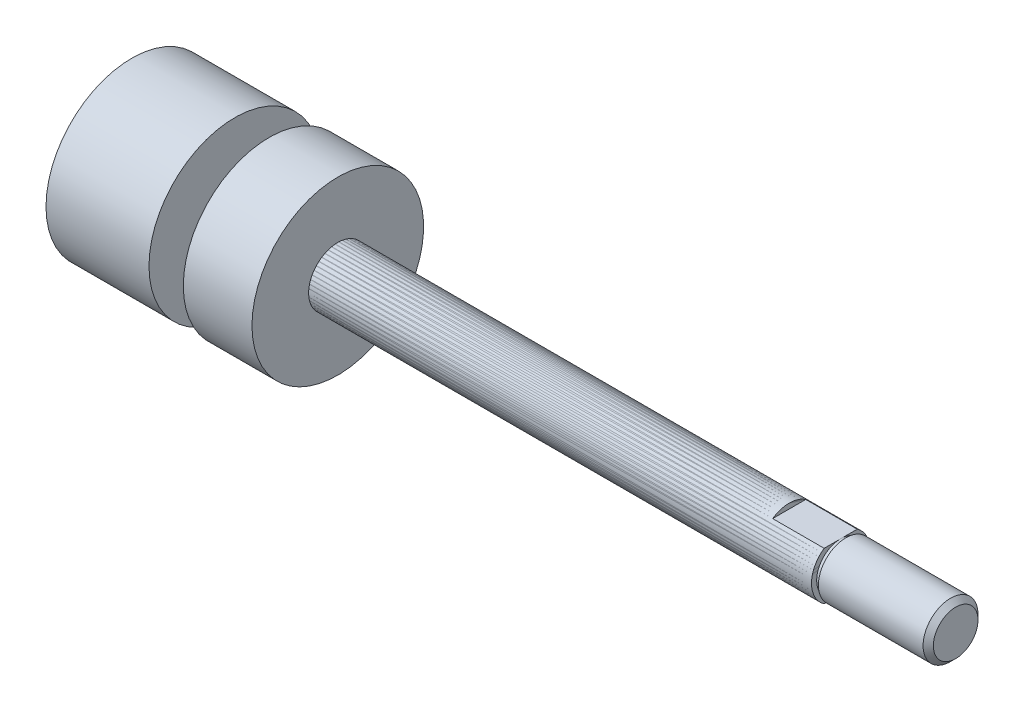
SolidWorks part; units mm, degrees
ref_plane "Face" through (0, 0, 0) normal (0, 0, 1) x (1, 0, 0)
ref_plane "Dessus" through (0, 0, 0) normal (0, 1, 0) x (1, 0, 0)
ref_plane "Droite" through (0, 0, 0) normal (1, 0, 0) x (0, 0, -1)
imported_body "Importée1"
sketch "Esquisse1" plane through (-60.7813, 0, 0) normal (1, 0, 0) x (0, 0, -1)
  circle A0 centre (9.7841, -14.4617) radius 49.5257
extrude "Enlèv. mat.-Extru.1" cut sketch "Esquisse1" against normal up to next
sketch "Esquisse2" plane through (-60.7813, 0, 0) normal (-1, 0, 0) x (0, 0, 1)
  circle A0 centre (0, 0) radius 8.5
extrude "Extrusion1" add sketch "Esquisse2" along normal blind 30
sketch "Esquisse3" plane through (-90.7813, 0, 0) normal (-1, 0, 0) x (0, 0, 1)
  circle A0 centre (0, 0) radius 25
extrude "Extrusion2" add sketch "Esquisse3" along normal blind 30
